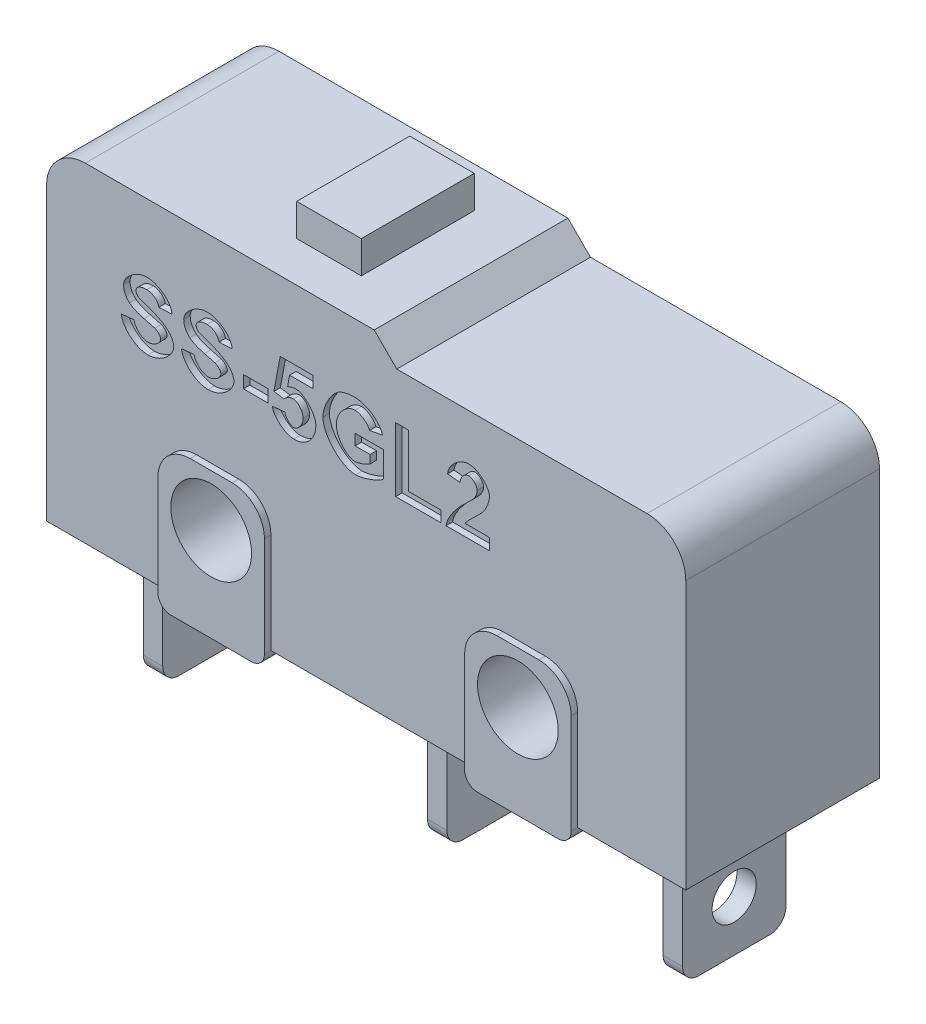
SolidWorks part; units mm, degrees
other "Solid1"
ref_plane "Płaszczyzna przednia" through (0, 0, 0) normal (0, 0, 1) x (1, 0, 0)
ref_plane "Płaszczyzna górna" through (0, 0, 0) normal (0, 1, 0) x (1, 0, 0)
ref_plane "Płaszczyzna prawa" through (0, 0, 0) normal (1, 0, 0) x (0, 0, -1)
imported_body "Import1"
sketch "Szkic1" plane through (0, 10.7497, 0) normal (0, 1, 0) x (1, 0, 0)
  line L0 (-3.3808, -6.2) -> (-3.3808, -0.2) construction
  line L1 (3.1192, -1.45) -> (5.1192, -1.45)
  line L2 (3.1192, -1.45) -> (3.1192, -4.95)
  line L3 (3.1192, -4.95) -> (5.1192, -4.95)
  line L4 (5.1192, -1.45) -> (5.1192, -4.95)
  line L5 (6.7685, -6.2) -> (6.7685, -0.2) construction
  point P6 (5.1192, -3.2)
  point P9 (6.7685, -3.2)
  dimension "D1" = 2
  dimension "D2" = 8.5
  dimension "D3" = 3.5
extrude "Dodanie-wyciągnięcie1" add sketch "Szkic1" along normal blind 1
